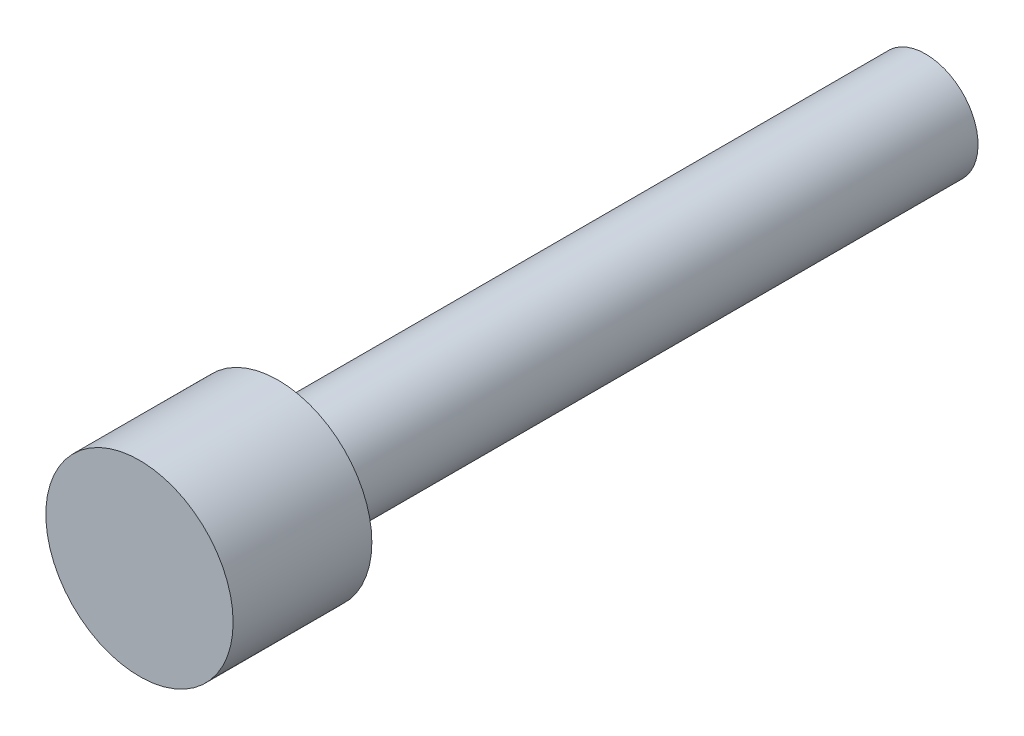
SolidWorks part; units mm, degrees
ref_plane "Front Plane" through (0, 0, 0) normal (0, 0, 1) x (1, 0, 0)
ref_plane "Top Plane" through (0, 0, 0) normal (0, 1, 0) x (1, 0, 0)
ref_plane "Right Plane" through (0, 0, 0) normal (1, 0, 0) x (0, 0, -1)
sketch "Sketch1" plane through (0, 0, 0) normal (0, 0, 1) x (1, 0, 0)
  circle A0 centre (0, 0) radius 6.4294 construction
  circle A1 centre (0, 0) radius 6.4294
extrude "Boss-Extrude1" add sketch "Sketch1" against normal up to surface (9.525 mm away)
sketch "Sketch2" plane through (0, 0, -9.525) normal (0, 0, -1) x (-1, 0, 0)
  circle A0 centre (0, 0) radius 3.5954
  dimension "D1" = 7.1907
extrude "Boss-Extrude2" add sketch "Sketch2" along normal up to surface (44.45 mm away)
